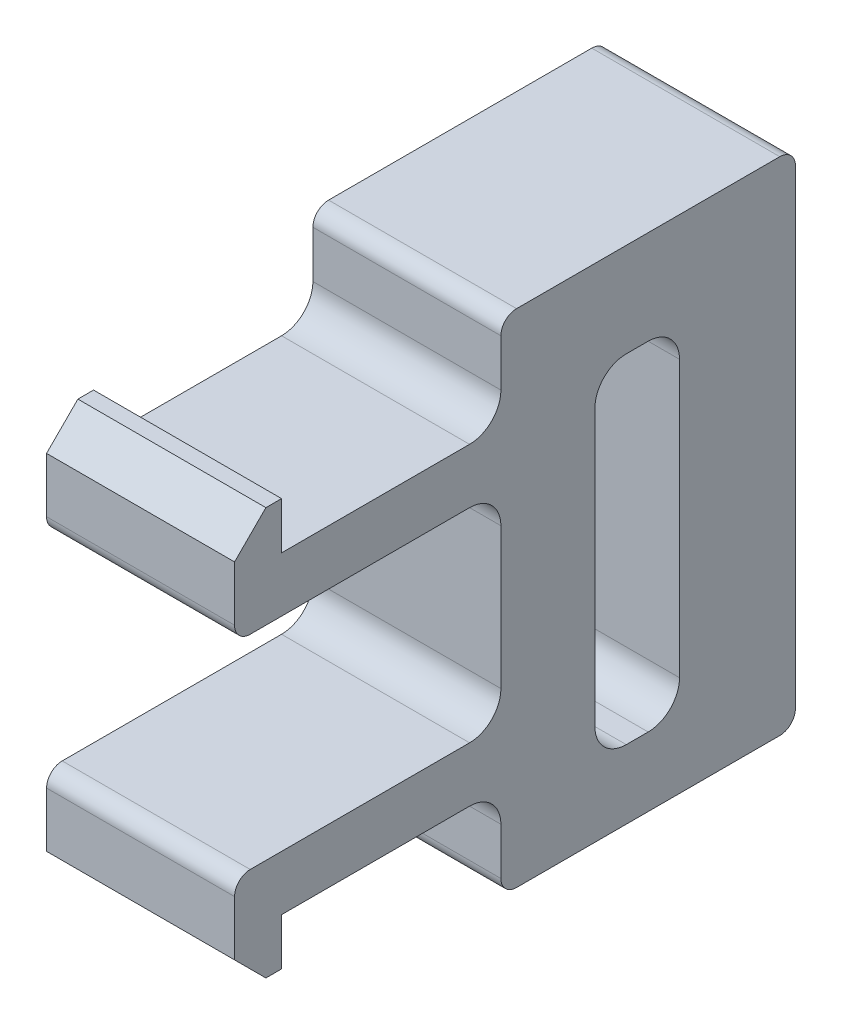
SolidWorks part; units mm, degrees
ref_plane "Plan de face" through (0, 0, 0) normal (0, 0, 1) x (1, 0, 0)
ref_plane "Plan de dessus" through (0, 0, 0) normal (0, 1, 0) x (1, 0, 0)
ref_plane "Plan de droite" through (0, 0, 0) normal (1, 0, 0) x (0, 0, -1)
sketch "Esquisse1" plane through (0, 0, 0) normal (0, 0, 1) x (1, 0, 0)
  line L0 (52.8, 45.5898) -> (52.8, 29.5898)
  line L3 (52.8, 29.5898) -> (58.8, 29.5898)
  line L4 (58.8, 29.5898) -> (58.8, 45.5898)
  line L5 (58.8, 45.5898) -> (52.8, 45.5898)
  line L6 (55.8, 42.4523) -> (55.8, 32.7471) construction
  dimension "D1" = 6
  dimension "D2" = 16
extrude "Extrusion1" add sketch "Esquisse1" along normal blind 3.7
sketch "Esquisse2" plane through (0, 0, 3.7) normal (0, 0, 1) x (1, 0, 0)
  line L0 (52.8, 45.5898) -> (52.8, 42.5898)
  line L1 (52.8, 45.5898) -> (58.8, 45.5898)
  line L2 (52.8, 42.5898) -> (58.8, 42.5898)
  line L3 (58.8, 45.5898) -> (58.8, 42.5898)
  line L4 (52.8, 45.5898) -> (52.8, 29.5898) construction
  line L5 (58.8, 29.5898) -> (58.8, 45.5898) construction
  line L6 (55.8, 29.5898) -> (55.8, 31.7898)
  line L7 (55.8, 29.5898) -> (58.8, 29.5898)
  line L8 (55.8, 31.7898) -> (58.8, 31.7898)
  line L9 (58.8, 29.5898) -> (58.8, 31.7898)
  dimension "D1" = 3
  dimension "D2" = 2.2
  dimension "D3" = 3
extrude "Extrusion2" add sketch "Esquisse2" along normal blind 2.7
sketch "Esquisse3" plane through (0, 0, 3.7) normal (0, 0, 1) x (1, 0, 0)
  line L0 (52.8, 29.5898) -> (55.8, 29.5898)
  line L1 (52.8, 29.5898) -> (52.8, 40.5898)
  line L2 (55.8, 29.5898) -> (55.8, 40.5898)
  line L3 (52.8, 40.5898) -> (55.8, 40.5898)
  line L4 (52.8, 29.5898) -> (55.8, 29.5898) construction
  line L5 (55.8, 31.7898) -> (55.8, 29.5898) construction
  dimension "D1" = 11
extrude "Enlèv. mat.-Extru.1" cut sketch "Esquisse3" against normal blind 5
sketch "Esquisse4" plane through (0, 0, 6.4) normal (0, 0, 1) x (1, 0, 0)
  line L0 (52.8, 45.5898) -> (52.8, 29.5898)
  line L1 (52.8, 45.5898) -> (58.8, 45.5898)
  line L2 (58.8, 45.5898) -> (58.8, 29.5898)
  line L3 (58.8, 29.5898) -> (52.8, 29.5898)
extrude "Extrusion3" add sketch "Esquisse4" along normal blind 3
sketch "Esquisse5" plane through (52.8, 0, 0) normal (-1, 0, 0) x (0, 0, 1)
  line L0 (9.4, 37.5898) -> (12.3106, 37.5898) construction
  line L1 (9.4, 45.5898) -> (9.4, 29.5898) construction
  line L2 (8.1832, 42.5898) -> (16.4, 42.5898)
  line L4 (17.9, 44.0898) -> (17.9, 40.8398)
  line L5 (8.1832, 32.5898) -> (16.4, 32.5898)
  line L6 (16.4, 42.5898) -> (16.4, 44.0898)
  line L7 (16.4, 44.0898) -> (17.9, 44.0898)
  line L8 (16.4, 32.5898) -> (16.4, 31.0898)
  line L9 (16.4, 31.0898) -> (17.9, 31.0898)
  line L10 (17.9, 40.8398) -> (9.2, 40.8398)
  line L11 (8.1832, 42.5898) -> (8.1832, 32.5898)
  line L12 (9.2, 40.8398) -> (9.2, 34.3398)
  line L13 (17.9, 34.3398) -> (9.2, 34.3398)
  line L15 (17.9, 34.3398) -> (17.9, 31.0898)
  dimension "D1" = 10
  dimension "D2" = 1.5
  dimension "D3" = 1.5
  dimension "D4" = 6.5
  dimension "D5" = 8.5
  dimension "D6" = 8.7
  dimension "D7" = 1.5
extrude "Extrusion4" add sketch "Esquisse5" along direction (-1, 0, 0) on the side against the normal up to surface (6 mm away)
chamfer "Chanfrein1" distance 1 angle 45 2 edges at (55.8, 31.0898, 17.9) (55.8, 44.0898, 17.9)
fillet "Congé1" radius 1 9 edges at (55.8, 40.5898, 1.85) (55.8, 42.5898, 6.4) (57.3, 31.7898, 3.7) (57.3, 31.7898, 6.4) (55.8, 34.3398, 9.4) (55.8, 42.5898, 9.4) (55.8, 32.5898, 9.4) (55.8, 40.8398, 9.4)
fillet "Congé2" radius 0.5 6 edges at (55.8, 34.3398, 17.9) (55.8, 40.8398, 17.9) (55.8, 45.5898, 9.4) (55.8, 45.5898, 0) (55.8, 29.5898, 9.4) (57.3, 29.5898, 0)
sketch "Esquisse6" plane through (0, 0, 0) normal (0, 0, -1) x (-1, 0, 0)
  line L0 (-56.8, 29.5898) -> (-52.3818, 46.0786)
  line L1 (-55.8, 29.5898) -> (-58.8, 29.5898) construction
  line L2 (-58.8, 30.0898) -> (-58.8, 45.0898) construction
  line L3 (-52.8, 29.5898) -> (-55.8, 29.5898) construction
  line L4 (-56.8, 29.5898) -> (-52.3818, 29.5898)
  line L5 (-52.3818, 29.5898) -> (-52.3818, 46.0786)
  dimension "D1" = 2
  dimension "D2" = 75
extrude "Enlèv. mat.-Extru.2" cut sketch "Esquisse6" against normal up to surface (6.4 mm away)
